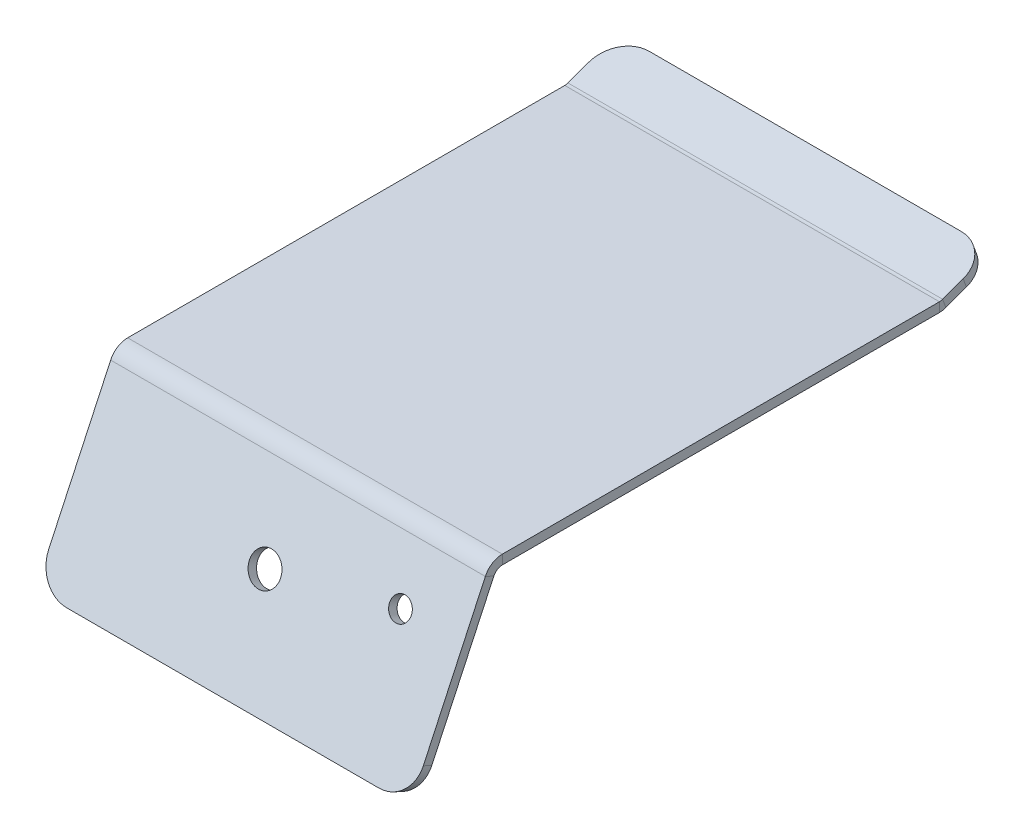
SolidWorks part; units mm, degrees
ref_plane "Front" through (0, 0, 0) normal (0, 0, 1) x (1, 0, 0)
ref_plane "Top" through (0, 0, 0) normal (0, 1, 0) x (1, 0, 0)
ref_plane "Right" through (0, 0, 0) normal (1, 0, 0) x (0, 0, -1)
sketch "Sketch1" plane through (0, 0, 0) normal (0, 1, 0) x (1, 0, 0)
  line L1 (5, 0) -> (55, 0)
  line L2 (0, 5) -> (0, 105)
  line L3 (5, 110) -> (55, 110)
  line L4 (60, 5) -> (60, 105)
  circle A0 centre (30, 16) radius 2.5
  circle A1 centre (50, 20) radius 1.75
  arc A2 (60, 105) -> (55, 110) centre (55, 105) ccw
  arc A3 (55, 0) -> (60, 5) centre (55, 5) ccw
  arc A4 (0, 5) -> (5, 0) centre (5, 5) ccw
  arc A5 (5, 110) -> (0, 105) centre (5, 105) ccw
  point P11 (0, 0)
extrude "Extrude1" add sketch "Sketch1" along normal blind 1.5
sketch "Sketch2" plane through (0, 1.5, 0) normal (0, 1, 0) x (-1, 0, 0)
  line L3 (0, -100) -> (-60, -100)
sheet metal parameters "Sheet-Metal1" parameters "D1"=1.5
flatten bends "Flatten-Bends1" parameters "D1"=0
sketch "Sharp-Sketch1" plane through (0, 1.5, 0) normal (0, 1, 0) x (-1, 0, 0)
process bends "Process-Bends1" parameters "D1"=0
sketch "Flat-Sketch1" plane through (0, 1.5, 0) normal (0, 1, 0) x (-1, 0, 0)
sketched bend "Sketched Bend1" parameters "D1"=1.5
bend "SketchBend1" bend radius 1.5 bend angle 20 parameters "D5"=1
sketch "Sketch9" plane through (0, 1.5, 0) normal (0, 1, 0) x (-1, 0, 0)
  line L5 (0, -30) -> (-60, -30)
sketched bend "Sketched Bend2" parameters "D1"=1.5
bend "SketchBend2" bend radius 1.5 bend angle 65 parameters "D5"=2
flat pattern "Flat-Pattern1"
sketch "Bend-Lines1" plane through (0, 1.5, 0) normal (0, 1, 0) x (-1, 0, 0)
  line L0 (-60, -29.25) -> (0, -29.25) construction
  line L1 (-60, -100.75) -> (0, -100.75) construction
bend of the flat pattern "Flatten-<SketchBend1>1"
bend of the flat pattern "Flatten-<SketchBend2>1"
